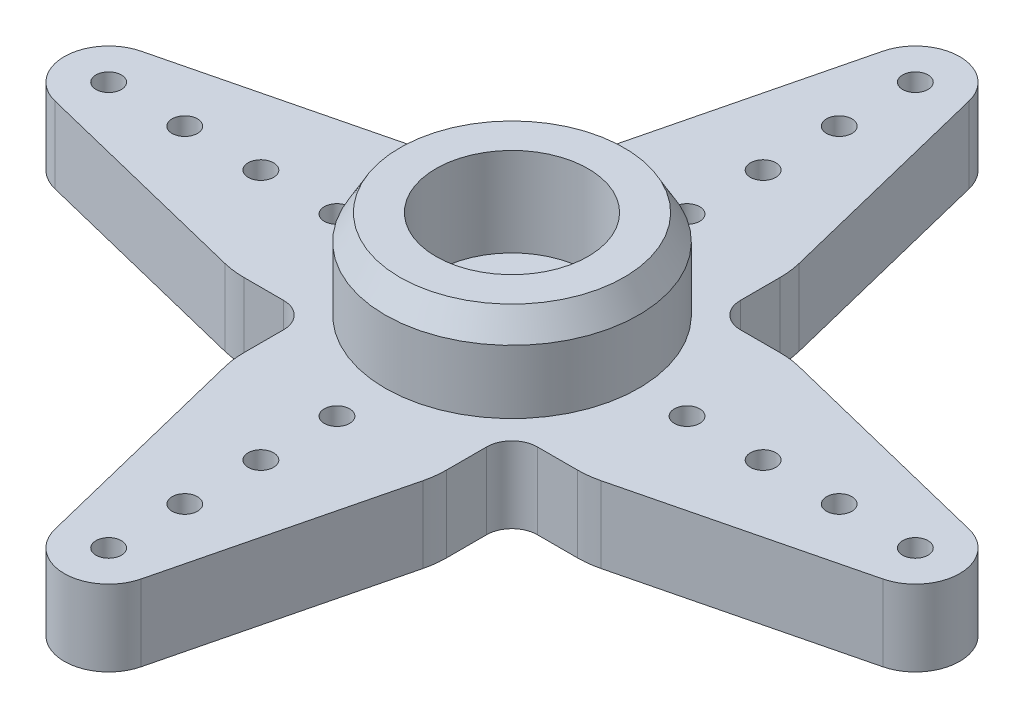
SolidWorks part; units mm, degrees
ref_plane "Alzado" through (0, 0, 0) normal (0, 0, 1) x (1, 0, 0)
ref_plane "Planta" through (0, 0, 0) normal (0, 1, 0) x (1, 0, 0)
ref_plane "Vista lateral" through (0, 0, 0) normal (1, 0, 0) x (0, 0, -1)
sketch "Croquis1" plane through (0, 0, 0) normal (0, 1, 0) x (1, 0, 0)
  line L0 (-4, 0) -> (-4, 6.5743)
  line L1 (-3.898, 7.4133) -> (-1.699, 16.3191)
  line L2 (1.699, 16.3191) -> (3.898, 7.4133)
  line L3 (4, 6.5743) -> (4, 0)
  line L4 (4, 0) -> (1.25, 0)
  line L5 (-4, 0) -> (-1.25, 0)
  line L6 (0, 0) -> (0, 23.2) construction
  arc A0 (1.25, 0) -> (-1.25, 0) centre (0, 0) ccw
  arc A1 (-1.699, 16.3191) -> (1.699, 16.3191) centre (0, 15.8996) cw
  arc A2 (-4, 6.5743) -> (-3.898, 7.4133) centre (-0.5, 6.5743) cw
  arc A3 (3.898, 7.4133) -> (4, 6.5743) centre (0.5, 6.5743) cw
  circle A4 centre (0, 15.8996) radius 0.5
  circle A5 centre (0, 12.8996) radius 0.5
  circle A6 centre (0, 9.8996) radius 0.5
  circle A7 centre (0, 6.8996) radius 0.5
  point P14 (-4, 7)
  dimension "D1" = 1.25
  dimension "D5" = 1.75
  dimension "D6" = 3.5
  dimension "D7" = 1
  dimension "D2" = 8
  dimension "D3" = 7
  dimension "D4" = 23.2
  dimension "D8" = 4
extrude "Saliente-Extruir1" add sketch "Croquis1" along normal blind 3
pattern_circular "MatrizC1" count 4 every 90 about axis through (0, 0, 0) along (0, 1, 0) of "Saliente-Extruir1"
sketch "Croquis2" plane through (0, 3, 0) normal (0, 1, 0) x (1, 0, 0)
  circle A0 centre (0, 0) radius 3
  circle A1 centre (0, 0) radius 5
  dimension "D1" = 6
  dimension "D2" = 10
extrude "Saliente-Extruir2" add sketch "Croquis2" along normal blind 3.5
chamfer "Chaflán1" distance 1 angle 30 1 edges at (0, 6.5, 5)
fillet "Redondeo1" radius 1 4 edges at (4, 1.5, -4) (-4, 1.5, -4) (-4, 1.5, 4) (4, 1.5, 4)
sketch "Croquis5" plane through (0, 0, 0) normal (0, 1, 0) x (1, 0, 0)
  line L16 (6.5743, 4) -> (5, 4)
  line L17 (4, 5) -> (4, 6.5743)
  line L18 (3.898, 7.4133) -> (1.699, 16.3191)
  line L19 (-1.699, 16.3191) -> (-3.898, 7.4133)
  line L20 (-4, 6.5743) -> (-4, 5)
  line L21 (-5, 4) -> (-6.5743, 4)
  line L22 (-7.4133, 3.898) -> (-16.3191, 1.699)
  line L23 (-16.3191, -1.699) -> (-7.4133, -3.898)
  line L24 (-6.5743, -4) -> (-5, -4)
  line L25 (-4, -5) -> (-4, -6.5743)
  line L26 (-3.898, -7.4133) -> (-1.699, -16.3191)
  line L27 (1.699, -16.3191) -> (3.898, -7.4133)
  line L28 (4, -6.5743) -> (4, -5)
  line L29 (5, -4) -> (6.5743, -4)
  line L30 (7.4133, -3.898) -> (16.3191, -1.699)
  line L31 (16.3191, 1.699) -> (7.4133, 3.898)
  line L32 (6.5743, 4) -> (5, 4)
  line L33 (4, 5) -> (4, 6.5743)
  line L34 (3.898, 7.4133) -> (1.699, 16.3191)
  line L35 (-1.699, 16.3191) -> (-3.898, 7.4133)
  line L36 (-4, 6.5743) -> (-4, 5)
  line L37 (-5, 4) -> (-6.5743, 4)
  line L38 (-7.4133, 3.898) -> (-16.3191, 1.699)
  line L39 (-16.3191, -1.699) -> (-7.4133, -3.898)
  line L40 (-6.5743, -4) -> (-5, -4)
  line L41 (-4, -5) -> (-4, -6.5743)
  line L42 (-3.898, -7.4133) -> (-1.699, -16.3191)
  line L43 (1.699, -16.3191) -> (3.898, -7.4133)
  line L44 (4, -6.5743) -> (4, -5)
  line L45 (5, -4) -> (6.5743, -4)
  line L46 (7.4133, -3.898) -> (16.3191, -1.699)
  line L47 (16.3191, 1.699) -> (7.4133, 3.898)
  circle A0 centre (-9.8996, 0) radius 0.5 construction
  circle A1 centre (0, 9.8996) radius 0.5 construction
  circle A2 centre (9.8996, 0) radius 0.5 construction
  circle A3 centre (0, -6.8996) radius 0.5 construction
  circle A4 centre (-9.8996, 0) radius 0.5
  circle A5 centre (0, 9.8996) radius 0.5
  circle A6 centre (9.8996, 0) radius 0.5
  circle A7 centre (0, -6.8996) radius 0.5
  arc A16 (4, 5) -> (5, 4) centre (5, 5) ccw
  arc A17 (4, 6.5743) -> (3.898, 7.4133) centre (0.5, 6.5743) ccw
  arc A18 (1.699, 16.3191) -> (-1.699, 16.3191) centre (0, 15.8996) ccw
  arc A19 (-3.898, 7.4133) -> (-4, 6.5743) centre (-0.5, 6.5743) ccw
  arc A20 (-5, 4) -> (-4, 5) centre (-5, 5) ccw
  arc A21 (-6.5743, 4) -> (-7.4133, 3.898) centre (-6.5743, 0.5) ccw
  arc A22 (-16.3191, 1.699) -> (-16.3191, -1.699) centre (-15.8996, 0) ccw
  arc A23 (-7.4133, -3.898) -> (-6.5743, -4) centre (-6.5743, -0.5) ccw
  arc A24 (-4, -5) -> (-5, -4) centre (-5, -5) ccw
  arc A25 (-4, -6.5743) -> (-3.898, -7.4133) centre (-0.5, -6.5743) ccw
  arc A26 (-1.699, -16.3191) -> (1.699, -16.3191) centre (0, -15.8996) ccw
  arc A27 (3.898, -7.4133) -> (4, -6.5743) centre (0.5, -6.5743) ccw
  arc A28 (5, -4) -> (4, -5) centre (5, -5) ccw
  arc A29 (6.5743, -4) -> (7.4133, -3.898) centre (6.5743, -0.5) ccw
  arc A30 (16.3191, -1.699) -> (16.3191, 1.699) centre (15.8996, 0) ccw
  arc A31 (7.4133, 3.898) -> (6.5743, 4) centre (6.5743, 0.5) ccw
  arc A32 (4, 5) -> (5, 4) centre (5, 5) ccw
  arc A33 (4, 6.5743) -> (3.898, 7.4133) centre (0.5, 6.5743) ccw
  arc A34 (1.699, 16.3191) -> (-1.699, 16.3191) centre (0, 15.8996) ccw
  arc A35 (-3.898, 7.4133) -> (-4, 6.5743) centre (-0.5, 6.5743) ccw
  arc A36 (-5, 4) -> (-4, 5) centre (-5, 5) ccw
  arc A37 (-6.5743, 4) -> (-7.4133, 3.898) centre (-6.5743, 0.5) ccw
  arc A38 (-16.3191, 1.699) -> (-16.3191, -1.699) centre (-15.8996, 0) ccw
  arc A39 (-7.4133, -3.898) -> (-6.5743, -4) centre (-6.5743, -0.5) ccw
  arc A40 (-4, -5) -> (-5, -4) centre (-5, -5) ccw
  arc A41 (-4, -6.5743) -> (-3.898, -7.4133) centre (-0.5, -6.5743) ccw
  arc A42 (-1.699, -16.3191) -> (1.699, -16.3191) centre (0, -15.8996) ccw
  arc A43 (3.898, -7.4133) -> (4, -6.5743) centre (0.5, -6.5743) ccw
  arc A44 (5, -4) -> (4, -5) centre (5, -5) ccw
  arc A45 (6.5743, -4) -> (7.4133, -3.898) centre (6.5743, -0.5) ccw
  arc A46 (16.3191, -1.699) -> (16.3191, 1.699) centre (15.8996, 0) ccw
  arc A47 (7.4133, 3.898) -> (6.5743, 4) centre (6.5743, 0.5) ccw
  dimension "D1" = 0
sketch "Croquis6" plane through (0, 0, 0) normal (0, -1, 0) x (1, 0, 0)
  line L0 (0, 0) -> (15.8996, 0) construction
